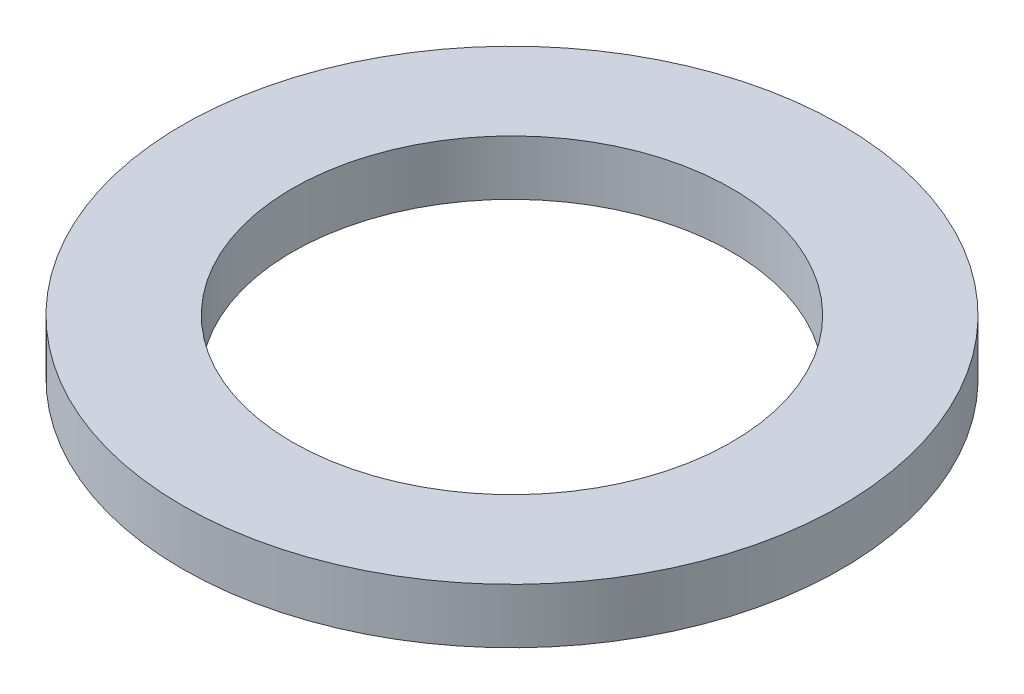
SolidWorks part; units mm, degrees
ref_plane "Спереди" through (0, 0, 0) normal (0, 0, 1) x (1, 0, 0)
ref_plane "Сверху" through (0, 0, 0) normal (0, 1, 0) x (1, 0, 0)
ref_plane "Справа" through (0, 0, 0) normal (1, 0, 0) x (0, 0, -1)
sketch "Эскиз1" plane through (0, 0, 0) normal (0, 1, 0) x (1, 0, 0)
  circle A0 centre (0, 0) radius 4
  circle A1 centre (0, 0) radius 6
  dimension "D1" = 8
  dimension "D2" = 12
extrude "Бобышка-Вытянуть1" add sketch "Эскиз1" along normal blind 1
